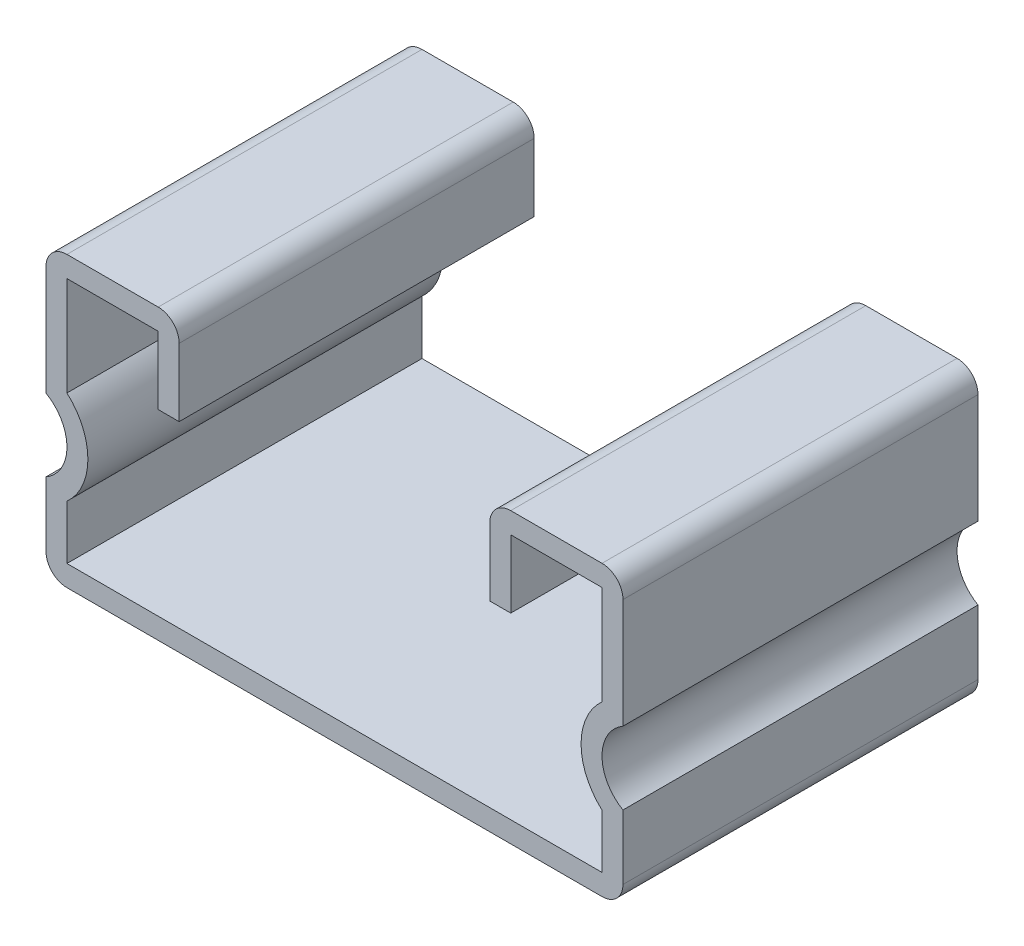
SolidWorks part; units mm, degrees
ref_plane "Plane1" through (0, 0, 0) normal (0, 0, 1) x (1, 0, 0)
ref_plane "Plane2" through (0, 0, 0) normal (0, 1, 0) x (1, 0, 0)
ref_plane "Plane3" through (0, 0, 0) normal (1, 0, 0) x (0, 0, -1)
sketch "Sketch1" plane through (0, 0, 0) normal (0, 0, 1) x (1, 0, 0)
  line L0 (-20.6375, 10.4394) -> (-20.6375, 2.5957)
  line L1 (-20.6375, -2.5957) -> (-20.6375, -7.2136)
  line L2 (-19.1389, -8.7122) -> (19.1389, -8.7122)
  line L3 (20.6375, -7.2136) -> (20.6375, -2.5957)
  line L4 (20.6375, 2.5957) -> (20.6375, 10.4394)
  line L5 (19.1389, 11.938) -> (12.6111, 11.938)
  line L6 (11.1125, 10.4394) -> (11.1125, 5.588)
  line L7 (-19.1389, 11.938) -> (-12.6111, 11.938)
  line L8 (-11.1125, 10.4394) -> (-11.1125, 5.588)
  line L9 (19.1389, -5.2823) -> (19.1389, 6.4389) construction
  line L10 (-19.1389, 6.4389) -> (-19.1389, -5.2823) construction
  line L11 (-12.6111, 10.4394) -> (-12.6111, 5.588)
  line L12 (-19.1389, 10.4394) -> (-12.6111, 10.4394)
  line L13 (-19.1389, 10.4394) -> (-19.1389, 3.351)
  line L14 (-19.1389, -3.351) -> (-19.1389, -7.2136)
  line L15 (-19.1389, -7.2136) -> (19.1389, -7.2136)
  line L16 (19.1389, -7.2136) -> (19.1389, -3.351)
  line L17 (19.1389, 3.351) -> (19.1389, 10.4394)
  line L18 (19.1389, 10.4394) -> (12.6111, 10.4394)
  line L19 (12.6111, 10.4394) -> (12.6111, 5.588)
  line L20 (-12.6111, 5.588) -> (-11.1125, 5.588)
  line L21 (11.1125, 5.588) -> (12.6111, 5.588)
  arc A0 (20.6375, 2.5957) -> (20.6375, -2.5957) centre (22.1361, 0) ccw
  arc A1 (-20.6375, -2.5957) -> (-20.6375, 2.5957) centre (-22.1361, 0) ccw
  arc A2 (-12.6111, 11.938) -> (-11.1125, 10.4394) centre (-12.6111, 10.4394) cw
  arc A3 (-20.6375, 10.4394) -> (-19.1389, 11.938) centre (-19.1389, 10.4394) cw
  arc A4 (-19.1389, -8.7122) -> (-20.6375, -7.2136) centre (-19.1389, -7.2136) cw
  arc A5 (20.6375, -7.2136) -> (19.1389, -8.7122) centre (19.1389, -7.2136) cw
  arc A6 (19.1389, 11.938) -> (20.6375, 10.4394) centre (19.1389, 10.4394) cw
  arc A7 (11.1125, 10.4394) -> (12.6111, 11.938) centre (12.6111, 10.4394) cw
  arc A8 (-19.1389, -3.351) -> (-19.1389, 3.351) centre (-22.1361, 0) ccw
  arc A9 (19.1389, 3.351) -> (19.1389, -3.351) centre (22.1361, 0) ccw
  dimension "D1" = 20.6375
  dimension "D9" = 2.9972
  dimension "D10" = 2.9972
  dimension "Width" = 41.275
  dimension "base" = 8.7122
  dimension "ToeHt" = 11.938
  dimension "D6" = 22.225
  dimension "edge" = 9.525
  dimension "Lip" = 6.35
  dimension "gauge" = 1.4986
extrude "Base-Extrude" add sketch "Sketch1" along normal mid plane 25.4
equation "\"D1@Sketch1\" = \"Width@Sketch1\" / 2"
equation "\"D6@Sketch1\" = \"Width@Sketch1\" - 2 * \"edge@Sketch1\""
equation "\"D10@Sketch1\" = 2 * \"gauge@Sketch1\""
equation "\"D9@Sketch1\" = \"D10@Sketch1\""
